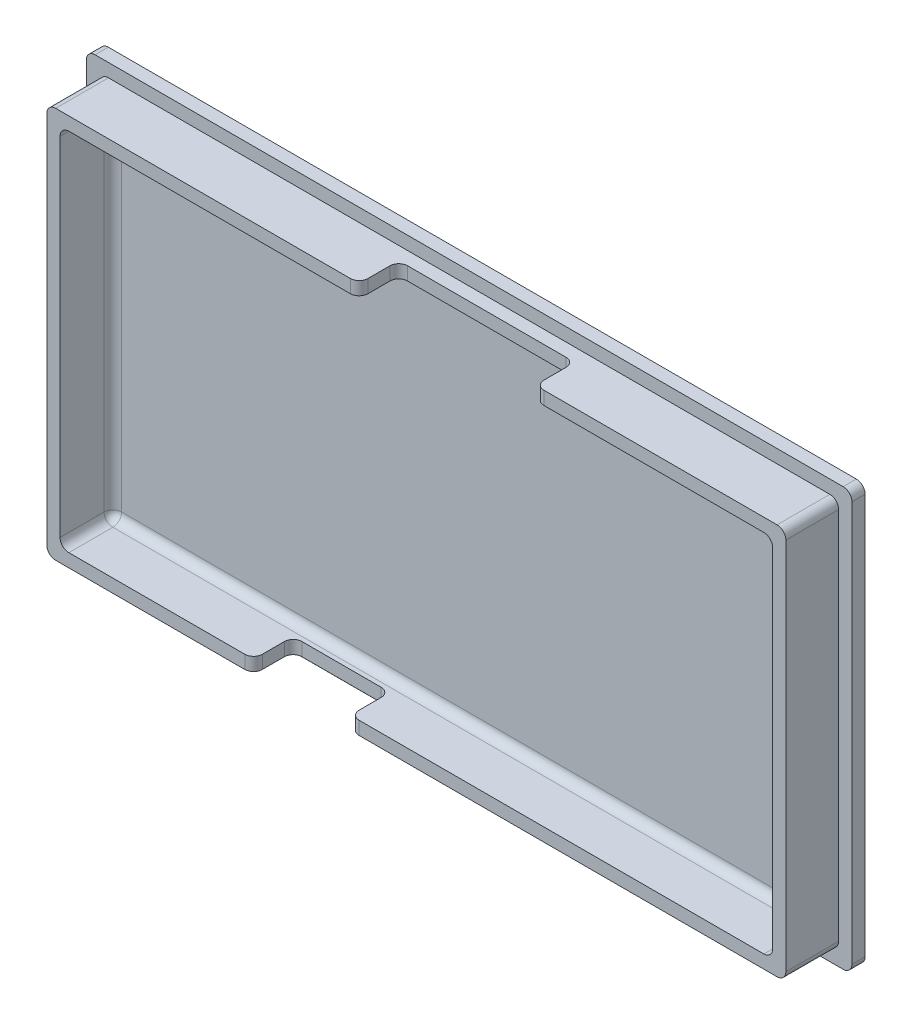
SolidWorks part; units mm, degrees
ref_plane "Спереди" through (0, 0, 0) normal (0, 0, 1) x (1, 0, 0)
ref_plane "Сверху" through (0, 0, 0) normal (0, 1, 0) x (1, 0, 0)
ref_plane "Справа" through (0, 0, 0) normal (1, 0, 0) x (0, 0, -1)
other "Configuration Table"
sketch "Эскиз1" plane through (0, 0, 0) normal (0, 0, 1) x (1, 0, 0)
  line L1 (43.5, 23.75) -> (-43.5, 23.75)
  line L2 (43.5, 23.75) -> (43.5, -23.75)
  line L3 (43.5, -23.75) -> (-43.5, -23.75)
  line L4 (-43.5, 23.75) -> (-43.5, -23.75)
  line L5 (43.5, 23.75) -> (-43.5, -23.75) construction
  line L6 (43.5, -23.75) -> (-43.5, 23.75) construction
  point P0 (0, 0)
  dimension "D1" = 47.5
  dimension "D2" = 87
extrude "Бобышка-Вытянуть1" add sketch "Эскиз1" along normal blind 1.5
sketch "Эскиз2" plane through (0, 0, 1.5) normal (0, 0, 1) x (1, 0, 0)
  line L0 (-43.5, 23.75) -> (-43.5, -23.75) construction
  line L1 (41.99, -22.24) -> (-41.99, -22.24)
  line L2 (41.99, -22.24) -> (41.99, 22.24)
  line L3 (41.99, 22.24) -> (-41.99, 22.24)
  line L4 (-41.99, -22.24) -> (-41.99, 22.24)
  line L5 (41.99, -22.24) -> (-41.99, 22.24) construction
  line L6 (41.99, 22.24) -> (-41.99, -22.24) construction
  line L7 (43.5, 23.75) -> (-43.5, 23.75) construction
  line L9 (40.49, -20.74) -> (-40.49, -20.74)
  line L10 (40.49, -20.74) -> (40.49, 20.74)
  line L11 (40.49, 20.74) -> (-40.49, 20.74)
  line L12 (-40.49, -20.74) -> (-40.49, 20.74)
  line L13 (40.49, -20.74) -> (-40.49, 20.74) construction
  line L14 (40.49, 20.74) -> (-40.49, -20.74) construction
  point P0 (0, 0)
  point P10 (0, 0)
  dimension "D1" = 1.51
  dimension "D2" = 1.51
  dimension "D3" = 1.5
  dimension "D4" = 1.5
extrude "Бобышка-Вытянуть2" add sketch "Эскиз2" along normal blind 6
fillet "Скругление1" radius 1 16 edges at (40.49, -20.74, 4.5) (0, -20.74, 1.5) (-40.49, -20.74, 4.5) (-40.49, 0, 1.5) (-40.49, 20.74, 4.5) (0, 20.74, 1.5) (40.49, 0, 1.5) (40.49, 20.74, 4.5) (43.5, 23.75, 0.75) (41.99, 22.24, 4.5) (43.5, -23.75, 0.75) (41.99, -22.24, 4.5) (-41.99, -22.24, 4.5) (-43.5, -23.75, 0.75) (-41.99, 22.24, 4.5) (-43.5, 23.75, 0.75)
sketch "Эскиз3" plane through (0, 0, 7.5) normal (0, 0, 1) x (1, 0, 0)
  line L0 (-43.5, 22.75) -> (-43.5, -22.75) construction
  line L1 (-6.5, 31.1114) -> (13.5, 31.1114)
  line L2 (-6.5, 31.1114) -> (-6.5, 11.6017)
  line L3 (-6.5, 11.6017) -> (13.5, 11.6017)
  line L4 (13.5, 31.1114) -> (13.5, 11.6017)
  line L5 (-6.5, 31.1114) -> (13.5, 11.6017) construction
  line L6 (-6.5, 11.6017) -> (13.5, 31.1114) construction
  line L7 (-40.99, -22.24) -> (40.99, -22.24) construction
  line L8 (-18.5, -17.3334) -> (-7.5, -17.3334)
  line L9 (-18.5, -17.3334) -> (-18.5, -27.1466)
  line L10 (-18.5, -27.1466) -> (-7.5, -27.1466)
  line L11 (-7.5, -17.3334) -> (-7.5, -27.1466)
  line L12 (-18.5, -17.3334) -> (-7.5, -27.1466) construction
  line L13 (-18.5, -27.1466) -> (-7.5, -17.3334) construction
  point P0 (3.5, 21.3565)
  point P7 (-13, -22.24)
  dimension "D1" = 37
  dimension "D2" = 20
  dimension "D3" = 25
  dimension "D4" = 11
extrude "Вырез-Вытянуть1" cut sketch "Эскиз3" against normal blind 4.5
fillet "Скругление2" radius 1 8 edges at (-6.5, 21.49, 3) (13.5, 21.49, 3) (13.5, 21.49, 7.5) (-6.5, 21.49, 7.5) (-7.5, -21.49, 7.5) (-7.5, -21.49, 3) (-18.5, -21.49, 3) (-18.5, -21.49, 7.5)
